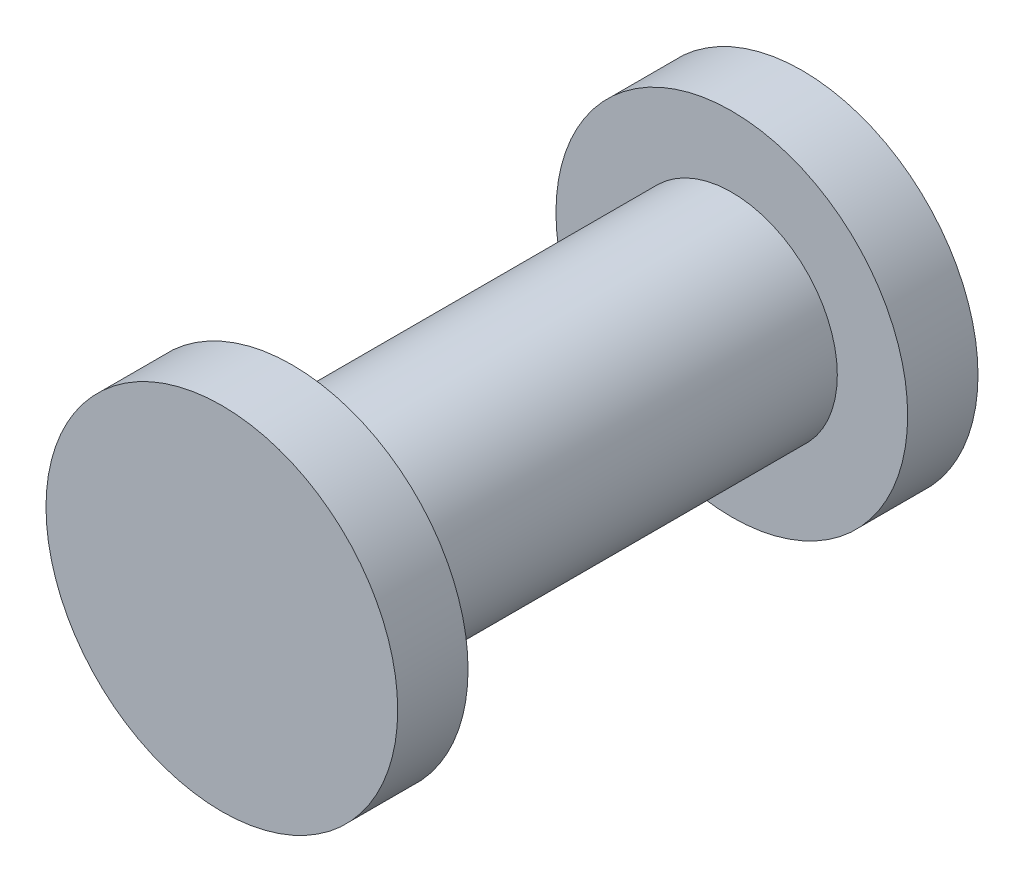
SolidWorks part; units mm, degrees
ref_plane "前视基准面" through (0, 0, 0) normal (0, 0, 1) x (1, 0, 0)
ref_plane "上视基准面" through (0, 0, 0) normal (0, 1, 0) x (1, 0, 0)
ref_plane "右视基准面" through (0, 0, 0) normal (1, 0, 0) x (0, 0, -1)
other "Configuration Table"
sketch "草图1" plane through (0, 0, 0) normal (0, 0, 1) x (1, 0, 0)
  circle A0 centre (0, 0) radius 5
  dimension "D1" = 10
extrude "Retained_Pin_D6" add sketch "草图1" against normal mid plane 16.5
sketch "草图2" plane through (0, 0, 0) normal (0, 0, 1) x (1, 0, 0)
  circle A0 centre (0, 0) radius 5.1
  circle A1 centre (0, 0) radius 3
  dimension "D1" = 6
  dimension "D2" = 10.2
extrude "Shaft_D6_EndCaps_D10" cut sketch "草图2" against normal mid plane 12.5
